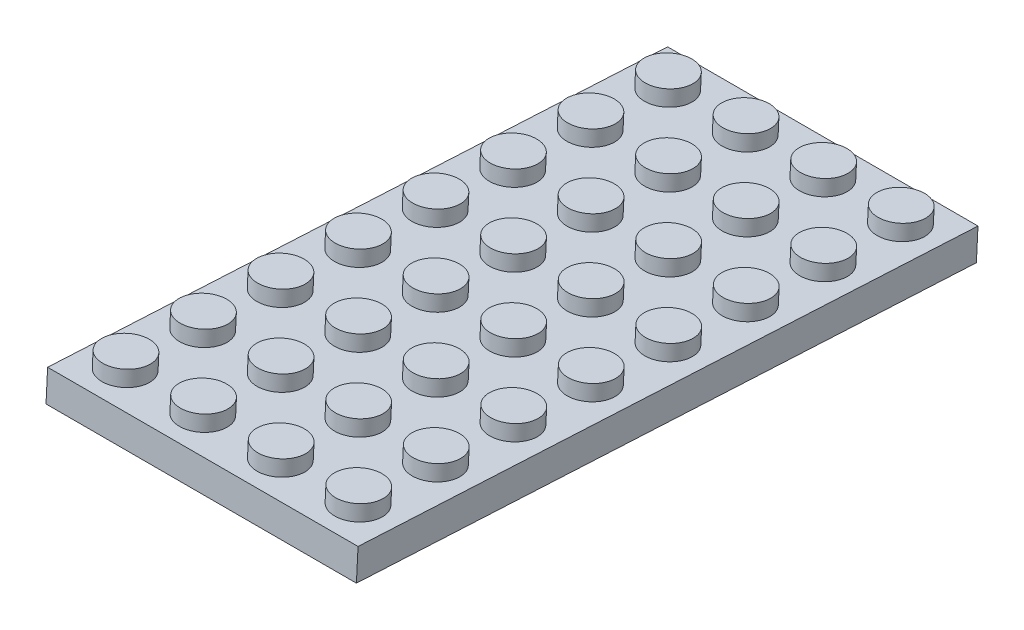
SolidWorks part; units mm, degrees
ref_plane "Front Plane" through (0, 0, 0) normal (0, 0, 1) x (1, 0, 0)
ref_plane "Top Plane" through (0, 0, 0) normal (0, 1, 0) x (1, 0, 0)
ref_plane "Right Plane" through (0, 0, 0) normal (1, 0, 0) x (0, 0, -1)
sketch "Sketch2" plane through (0, 0, 0) normal (0, 0, 1) x (1, 0, 0)
  line L1 (-16, -32) -> (16, -32)
  line L2 (-16, -32) -> (-16, 32)
  line L3 (-16, 32) -> (16, 32)
  line L4 (16, -32) -> (16, 32)
  line L5 (-16, -32) -> (16, 32) construction
  line L6 (-16, 32) -> (16, -32) construction
  point P0 (0, 0)
  dimension "D1" = 32
  dimension "D2" = 64
extrude "Boss-Extrude1" add sketch "Sketch2" along normal blind 3.2
sketch "Sketch3" plane through (0, 0, 0) normal (0, 0, -1) x (-1, 0, 0)
  line L0 (-16, 32) -> (16, 32) construction
  line L1 (-16, -32) -> (-16, 32) construction
  circle A0 centre (-12, 28) radius 2.4
  dimension "D3" = 4.8
  dimension "D1" = 4
  dimension "D2" = 4
extrude "Boss-Extrude2" add sketch "Sketch3" along normal blind 1.6
pattern_linear "LPattern1" count 4 spacing 8 along (-1, 0, 0) count 8 spacing 8 along (0, -1, 0) of "Boss-Extrude2"
shell "Shell1" thickness 1.6
sketch "Sketch4" plane through (0, 0, 1.6) normal (0, 0, 1) x (1, 0, 0)
  line L0 (14.4, 30.4) -> (-14.4, 30.4) construction
  line L1 (-14.4, 30.4) -> (-14.4, -30.4) construction
  circle A0 centre (-8.005, 24) radius 3.25
  dimension "D1" = 6.5
  dimension "D2" = 6.4
  dimension "D3" = 6.395
extrude "Boss-Extrude3" add sketch "Sketch4" along normal up to surface (1.6 mm away)
sketch "Sketch5" plane through (0, 0, 3.2) normal (0, 0, 1) x (1, 0, 0)
  line L2 (-16, 32) -> (-16, -32) construction
  line L3 (16, 32) -> (-16, 32) construction
  circle A0 centre (-8, 24) radius 2.4
  dimension "D1" = 4.8
  dimension "D2" = 8
  dimension "D3" = 8
extrude "Cut-Extrude1" cut sketch "Sketch5" against normal up to surface (1.6 mm away)
pattern_linear "LPattern2" count 7 spacing 8 along (0, -1, 0) count 3 spacing 8 along (1, 0, 0) of "Boss-Extrude3", "Cut-Extrude1"
move or copy body "Body-Move/Copy1" bodies to move or copy 108 copy no rotation origin (0, 0, 0.8) rotation axis (1, 0, 0) rotation angle 87
